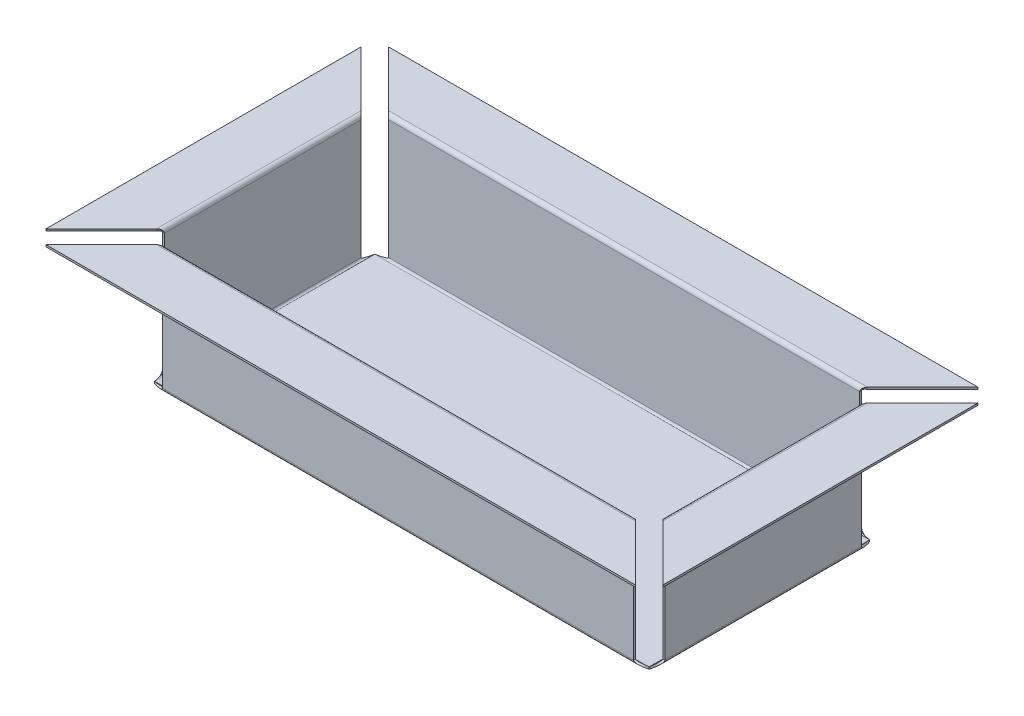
SolidWorks part; units mm, degrees
ref_plane "Front" through (0, 0, 0) normal (0, 0, 1) x (1, 0, 0)
ref_plane "Top" through (0, 0, 0) normal (0, 1, 0) x (1, 0, 0)
ref_plane "Right" through (0, 0, 0) normal (1, 0, 0) x (0, 0, -1)
sketch "Sketch1" plane through (0, 0, 0) normal (0, 1, 0) x (1, 0, 0)
  line L1 (-85.8398, 47.3147) -> (98.9308, 47.3147)
  line L2 (-85.8398, 47.3147) -> (-85.8398, -34.9718)
  line L3 (-85.8398, -34.9718) -> (98.9308, -34.9718)
  line L4 (98.9308, 47.3147) -> (98.9308, -34.9718)
sheet metal parameters "Sheet-Metal1" thickness 0.7366 parameters "D1"=0.7366
base flange "Base-Flange1" sketch "Sketch1" thickness 0.7366 reverse thickness direction yes parameters "D1"=0.7366
sketch "Sketch5" plane through (0, 0, 34.9718) normal (0, 0, 1) x (1, 0, 0)
  line L0 (98.9308, 0.7366) -> (98.9308, 47.5014)
  line L2 (98.9308, 47.5014) -> (121.0323, 47.5014)
miter flange "Miter Flange2" parameters "D1"=0.7366
bend "Miterbend9" bend radius 0.7366 bend angle 90 parameters "D5"=1
bend "Miterbend10" bend radius 0.7366 bend angle 90 parameters "D5"=2
bend "Miterbend11" bend radius 0.7366 bend angle 90 parameters "D5"=3
bend "Miterbend12" bend radius 0.7366 bend angle 90 parameters "D5"=4
bend "Miterbend13" bend radius 0.7366 bend angle 90 parameters "D5"=5
bend "Miterbend14" bend radius 0.7366 bend angle 90 parameters "D5"=6
bend "Miterbend15" bend radius 0.7366 bend angle 90 parameters "D5"=7
bend "Miterbend16" bend radius 0.7366 bend angle 90 parameters "D5"=8
flat pattern "Flat-Pattern1"
sketch "Bend-Lines1" plane through (0, 0.7366, 0) normal (0, 1, 0) x (-1, 0, 0)
  line L0 (86.3996, 35.8395) -> (-99.4906, 35.8395) construction
  line L1 (87.1362, 82.1301) -> (-100.2272, 82.1301) construction
  line L2 (86.7075, -47.8745) -> (86.7075, 35.5316) construction
  line L3 (132.9982, -48.6111) -> (132.9982, 36.2682) construction
  line L4 (-99.4906, -48.1825) -> (86.3996, -48.1825) construction
  line L5 (-100.2272, -94.4731) -> (87.1362, -94.4731) construction
  line L6 (-99.7986, 35.5316) -> (-99.7986, -47.8745) construction
  line L7 (-146.0892, 36.2682) -> (-146.0892, -48.6111) construction
bend of the flat pattern "Flatten-<Miterbend9>1"
bend of the flat pattern "Flatten-<Miterbend10>1"
bend of the flat pattern "Flatten-<Miterbend11>1"
bend of the flat pattern "Flatten-<Miterbend12>1"
bend of the flat pattern "Flatten-<Miterbend13>1"
bend of the flat pattern "Flatten-<Miterbend14>1"
bend of the flat pattern "Flatten-<Miterbend15>1"
bend of the flat pattern "Flatten-<Miterbend16>1"
